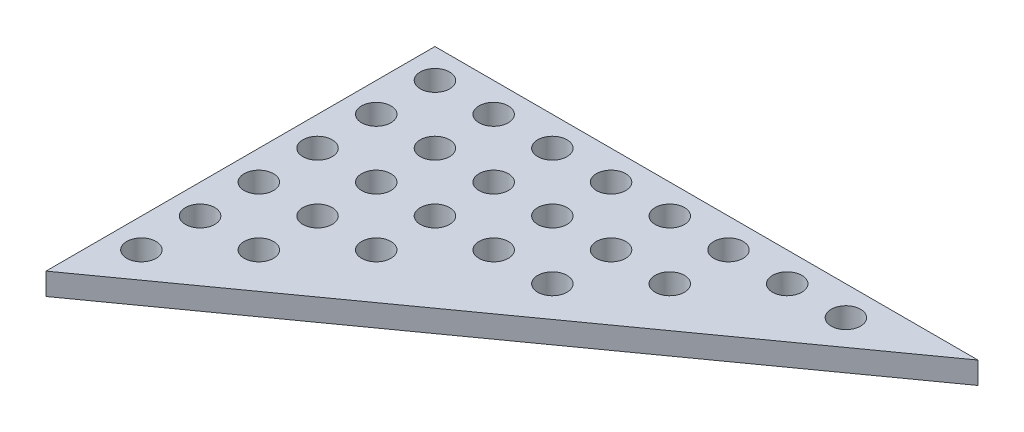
SolidWorks part; units mm, degrees
ref_plane "前视基准面" through (0, 0, 0) normal (0, 0, 1) x (1, 0, 0)
ref_plane "上视基准面" through (0, 0, 0) normal (0, 1, 0) x (1, 0, 0)
ref_plane "右视基准面" through (0, 0, 0) normal (1, 0, 0) x (0, 0, -1)
sketch "草图2" plane through (0, 0, 0) normal (0, 1, 0) x (1, 0, 0)
  line L0 (-61.9438, 34.9469) -> (-61.9438, -18.0531)
  line L1 (-61.9438, -18.0531) -> (12.0562, 34.9469)
  line L2 (12.0562, 34.9469) -> (-61.9438, 34.9469)
  circle A0 centre (-57.9438, 30.9469) radius 2
  circle A1 centre (-49.9438, 30.9469) radius 2
  circle A2 centre (-41.9438, 30.9469) radius 2
  circle A3 centre (-33.9438, 30.9469) radius 2
  circle A4 centre (-25.9438, 30.9469) radius 2
  circle A5 centre (-17.9438, 30.9469) radius 2
  circle A6 centre (-9.9438, 30.9469) radius 2
  circle A7 centre (-1.9438, 30.9469) radius 2
  circle A8 centre (-57.9437, 22.9469) radius 2
  circle A9 centre (-57.9437, 14.9469) radius 2
  circle A10 centre (-57.9437, 6.9469) radius 2
  circle A11 centre (-57.9437, -1.0531) radius 2
  circle A12 centre (-57.9437, -9.0531) radius 2
  circle A13 centre (-49.9437, 22.9469) radius 2
  circle A14 centre (-41.9437, 22.9469) radius 2
  circle A15 centre (-33.9437, 22.9469) radius 2
  circle A16 centre (-25.9437, 22.9469) radius 2
  circle A17 centre (-17.9437, 22.9469) radius 2
  circle A19 centre (-49.9437, 14.9469) radius 2
  circle A20 centre (-41.9437, 14.9469) radius 2
  circle A21 centre (-49.9437, 6.9469) radius 2
  circle A22 centre (-41.9437, 6.9469) radius 2
  circle A23 centre (-49.9437, -1.0531) radius 2
  circle A25 centre (-41.9437, -1.0531) radius 2
  circle A26 centre (-9.9437, 22.9469) radius 2
  circle A27 centre (-33.9437, 14.9469) radius 2
  circle A28 centre (-25.9437, 14.9469) radius 2
  dimension "D3" = 4
  dimension "D1" = 53
  dimension "D2" = 74
  dimension "D4" = 4
  dimension "D5" = 2
  dimension "D6" = 2
  dimension "D7" = 2
  dimension "D8" = 2
  dimension "D9" = 2
  dimension "D10" = 2
  dimension "D11" = 2
  dimension "D12" = 2
  dimension "D13" = 2
  dimension "D14" = 2
  dimension "D15" = 2
extrude "凸台-拉伸2" add sketch "草图2" along normal blind 3
